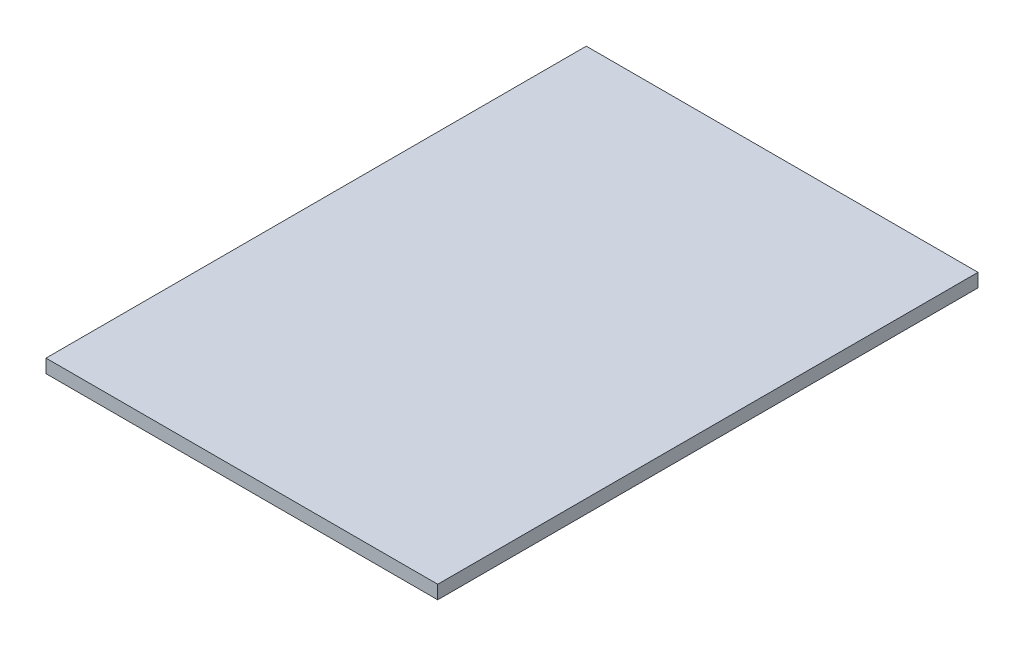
SolidWorks part; units mm, degrees
ref_plane "Front Plane" through (0, 0, 0) normal (0, 0, 1) x (1, 0, 0)
ref_plane "Top Plane" through (0, 0, 0) normal (0, 1, 0) x (1, 0, 0)
ref_plane "Right Plane" through (0, 0, 0) normal (1, 0, 0) x (0, 0, -1)
sketch "Sketch1" plane through (0, 0, 0) normal (0, 1, 0) x (1, 0, 0)
  line L1 (0, 0) -> (290, 0)
  line L2 (0, 0) -> (0, 400)
  line L3 (0, 400) -> (290, 400)
  line L4 (290, 0) -> (290, 400)
  dimension "D1" = 400
  dimension "D2" = 290
extrude "Boss-Extrude1" add sketch "Sketch1" along normal blind 10
